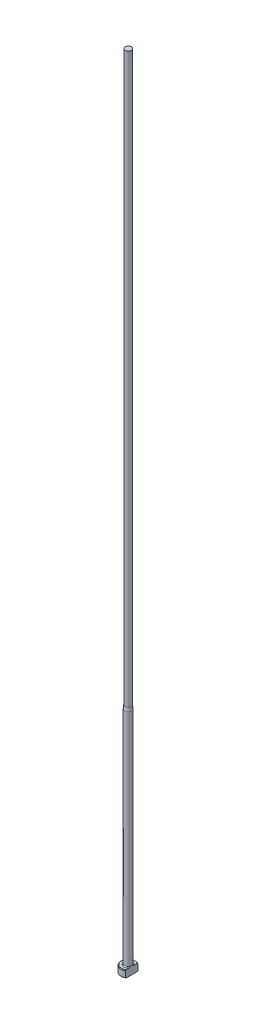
SolidWorks part; units mm, degrees
ref_plane "Front Plane" through (0, 0, 0) normal (0, 0, 1) x (1, 0, 0)
ref_plane "Top Plane" through (0, 0, 0) normal (0, 1, 0) x (1, 0, 0)
ref_plane "Right Plane" through (0, 0, 0) normal (1, 0, 0) x (0, 0, -1)
sketch "Sketch1" plane through (0, 0, 0) normal (0, 0, 1) x (1, 0, 0)
  line L0 (0, 259.9588) -> (0, -15.1925) construction
  line L1 (0, 0) -> (-3.175, 0)
  line L2 (-3.175, 0) -> (-3.175, 3.175)
  line L3 (-3.175, 3.175) -> (-1.5875, 3.175)
  line L4 (-1.3881, 103.1788) -> (-1.3881, 355.6)
  line L5 (-1.3881, 355.6) -> (0, 355.6)
  line L6 (0, 355.6) -> (0, 0)
  line L7 (-1.5875, 3.175) -> (-1.5875, 101.6)
  arc A0 (-1.5875, 101.6) -> (-1.3881, 103.1788) centre (-7.7381, 103.1788) ccw
  point P13 (-1.5875, 0)
  dimension "D1" = 6.35
  dimension "L" = 355.6
  dimension "D2" = 3.175
  dimension "H" = 6.35
  dimension "T" = 3.175
  dimension "D" = 2.7762
  dimension "S" = 101.6
revolve "Revolve1" add sketch "Sketch1" angle 360 about L0
chamfer "Chamfer1" distance 0.254 angle 45 2 edges at (0, 3.175, 3.175) (0, 0, 3.175)
fillet "Fillet1" radius 0.381 1 edges at (0, 3.175, 1.5875)
sketch "Sketch2" plane through (0, 0, 0) normal (0, 1, 0) x (1, 0, 0)
  line L0 (1.5875, -2.7496) -> (1.5875, 2.7496)
  circle A0 centre (0, 0) radius 3.175 construction
  arc A2 (1.5875, -2.7496) -> (1.5875, 2.7496) centre (0, 0) ccw
  circle A3 centre (0, 0) radius 3.175 construction
  circle A4 centre (0, 0) radius 1.5875 construction
extrude "Key Head" cut sketch "Sketch2" along normal up to next
